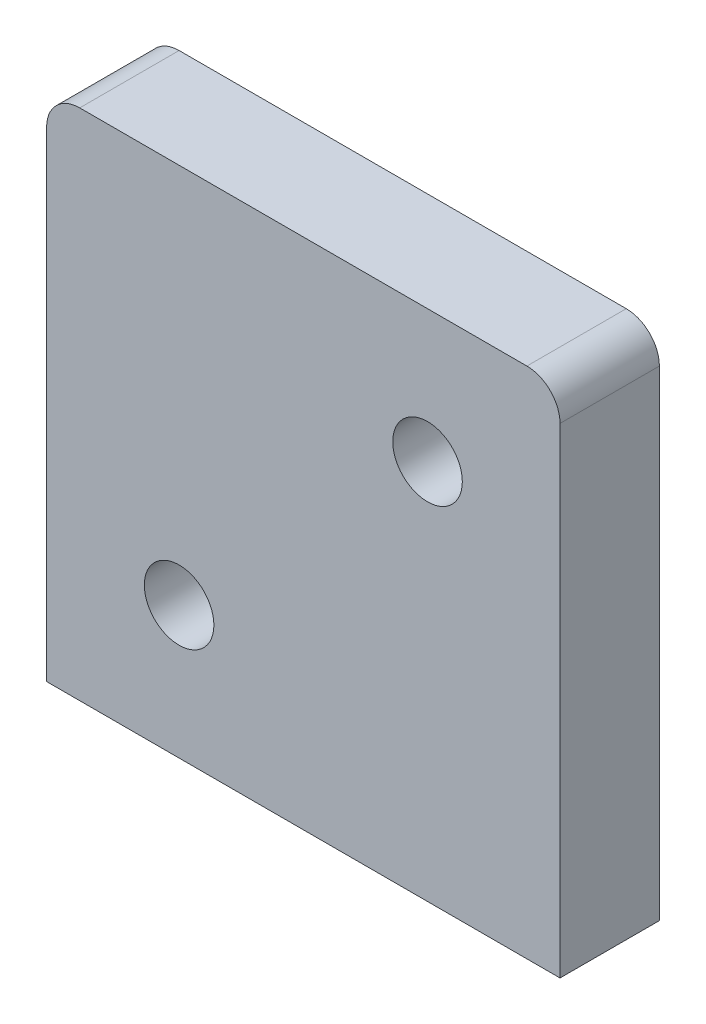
SolidWorks part; units mm, degrees
ref_plane "Спереди" through (0, 0, 0) normal (0, 0, 1) x (1, 0, 0)
ref_plane "Сверху" through (0, 0, 0) normal (0, 1, 0) x (1, 0, 0)
ref_plane "Справа" through (0, 0, 0) normal (1, 0, 0) x (0, 0, -1)
sketch "Эскиз1" plane through (0, 0, 0) normal (0, 0, 1) x (1, 0, 0)
  line L1 (0, 0) -> (31, 0)
  line L2 (0, 0) -> (0, 29)
  line L3 (2, 31) -> (29, 31)
  line L4 (31, 0) -> (31, 29)
  circle A0 centre (8, 23) radius 4 construction
  circle A1 centre (23, 23) radius 2.1
  circle A2 centre (8, 8) radius 2.1
  arc A3 (29, 31) -> (31, 29) centre (29, 29) cw
  arc A4 (0, 29) -> (2, 31) centre (2, 29) cw
  dimension "D1" = 8
  dimension "D8" = 2
  dimension "D9" = 4.2
  dimension "D2" = 8
  dimension "D3" = 8
  dimension "D4" = 15
  dimension "D5" = 8
  dimension "D6" = 8
  dimension "D7" = 15
extrude "Бобышка-Вытянуть1" add sketch "Эскиз1" along normal blind 6
